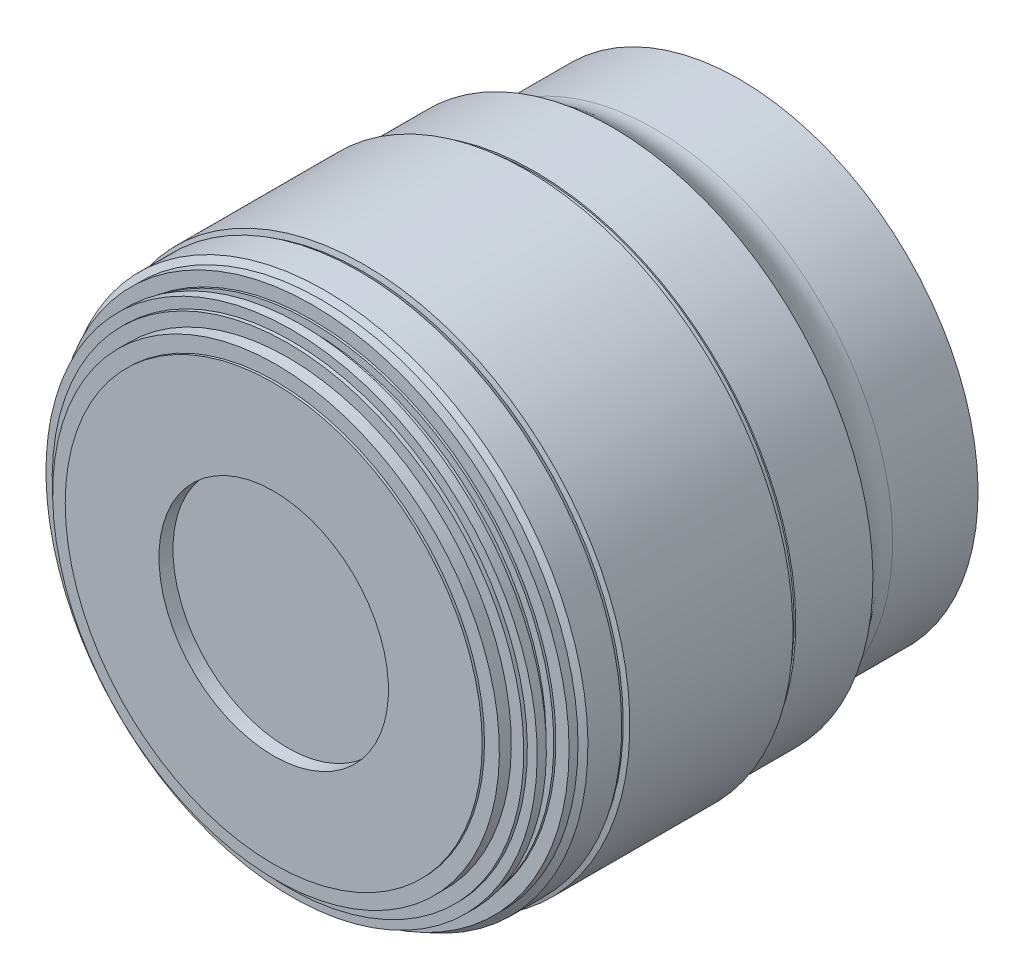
SolidWorks part; units mm, degrees
other "updated"
other "too small"
ref_plane "Front Plane" through (0, 0, 0) normal (0, 0, 1) x (1, 0, 0)
ref_plane "Top Plane" through (0, 0, 0) normal (0, 1, 0) x (1, 0, 0)
ref_plane "Right Plane" through (0, 0, 0) normal (1, 0, 0) x (0, 0, -1)
sketch "Sketch1" plane through (0, 0, 0) normal (1, 0, 0) x (0, 0, -1)
  line L0 (-736.0649, 115.0747) -> (23.9351, 115.0747) construction
sketch "Sketch2" plane through (0, 0, 0) normal (1, 0, 0) x (0, 0, -1)
  line B0 (0, 0) -> (-471.9893, 0)
  line B1 (0, 0) -> (0, 155.4973)
  line B2 (0, 155.4973) -> (-12.7948, 155.4973)
  line B3 (-12.7948, 155.4973) -> (-12.7948, 154.2945)
  line B4 (-12.7948, 154.2945) -> (-28.6883, 154.2945)
  line B5 (-28.6883, 154.2945) -> (-28.6883, 166.408)
  line B6 (-28.6883, 166.408) -> (-37.3653, 166.408)
  line B7 (-37.3653, 166.408) -> (-37.3653, 207.1469)
  line B8 (-37.3653, 207.1469) -> (-39.4783, 207.1469)
  line B9 (-39.4783, 207.1469) -> (-39.4783, 218.1634)
  line B10 (-39.4783, 218.1634) -> (-108.3379, 218.1634)
  line B11 (-149.8432, 238.8143) -> (-230.492, 238.8143)
  line B12 (-230.492, 238.8143) -> (-230.492, 235.6571)
  line B13 (-230.492, 235.6571) -> (-234.1288, 235.6571)
  line B14 (-234.1288, 235.6571) -> (-238.6808, 242.6516)
  line B15 (-238.6808, 242.6516) -> (-376.9383, 242.6516)
  line B16 (-376.9383, 242.6516) -> (-382.2862, 238.1946)
  line B17 (-382.2862, 238.1946) -> (-386.0216, 240.4231)
  line B18 (-386.0216, 240.4231) -> (-419.6297, 240.4231)
  line B19 (-419.6297, 240.4231) -> (-423.3041, 234.2639)
  line B20 (-423.3041, 234.2639) -> (-433.5787, 234.2639)
  line B21 (-433.5787, 234.2639) -> (-433.5787, 221.5093)
  line B22 (-433.5787, 221.5093) -> (-435.7, 221.5093)
  line B23 (-435.7, 221.5093) -> (-435.7, 213.879)
  line B24 (-435.7, 213.879) -> (-445.132, 213.879)
  line B25 (-445.132, 213.879) -> (-445.132, 223.6253)
  line B26 (-445.132, 223.6253) -> (-454.2554, 223.6253)
  line B27 (-454.2554, 223.6253) -> (-454.2554, 213.879)
  line B28 (-454.2554, 213.879) -> (-457.8412, 213.879)
  line B29 (-457.8412, 213.879) -> (-457.8412, 201.5319)
  line B30 (-457.8412, 201.5319) -> (-469.7007, 201.5319)
  line B31 (-469.7007, 201.5319) -> (-469.7007, 186.7774)
  line B32 (-469.7007, 186.7774) -> (-471.9893, 186.7774)
  line B33 (-471.9893, 186.7774) -> (-471.9893, 0)
  line B34 (-104.0623, 218.1634) -> (-112.6134, 218.1634) construction
  spline B35 degree 3 poles (-149.8432, 238.8143) (-137.6539, 228.0487) (-127.1212, 218.1634) (-108.3379, 218.1634) knots 0 0 0 0 1 1 1 1
sketch_block_instance "Block1-1"
sketch_block "Block1"
sketch "Sketch3" plane through (0, 0, 0) normal (1, 0, 0) x (0, 0, -1)
  line L36 (-19.4478, 30.9952) -> (-19.4478, 0) construction
  dimension "D1" = 30.9952
sketch_block_instance "Block2-1"
sketch_block "Block2"
revolve "Revolve2" add sketch "Sketch3" angle 360 about L0
sketch "Sketch4" plane through (0, 0, 0) normal (1, 0, 0) x (0, 0, -1)
  line L36 (-19.4478, 33.55) -> (-19.4478, 0) construction
  line L37 (0, 0) -> (-63.061, 0)
  line L39 (0, 22.5667) -> (-0.3172, 22.5667)
  line L40 (-0.3172, 22.5667) -> (-0.3172, 22.3985)
  line L41 (-0.3172, 22.3985) -> (-1.6606, 22.3985)
  line L42 (-1.6606, 22.3985) -> (-1.6606, 23.9828)
  line L43 (-1.6606, 23.9828) -> (-2.7867, 23.9828)
  line L44 (-2.7867, 23.9828) -> (-2.7867, 29.2702)
  line L45 (-2.7867, 29.2702) -> (-3.061, 29.2702)
  line L46 (-3.061, 29.2702) -> (-3.061, 30.7)
  line L47 (-3.061, 30.7) -> (-14.061, 30.7)
  line L48 (-19.4478, 33.55) -> (-29.385, 33.55)
  line L49 (-29.385, 33.55) -> (-29.385, 33.3422)
  line L50 (-29.385, 33.3422) -> (-29.8571, 33.3422)
  line L51 (-29.8571, 33.3422) -> (-30.4478, 34.25)
  line L52 (-30.4478, 34.25) -> (-51.4478, 34.25)
  line L53 (-51.4478, 34.25) -> (-51.5992, 33.55)
  line L54 (-51.5992, 33.55) -> (-52.1021, 33.85)
  line L55 (-52.1021, 33.85) -> (-56.4478, 33.85)
  line L56 (-56.4478, 33.85) -> (-56.9247, 33.0506)
  line L57 (-56.9247, 33.0506) -> (-58.0757, 33.0506)
  line L58 (-58.0757, 33.0506) -> (-58.0757, 31.354)
  line L59 (-58.0757, 31.354) -> (-58.351, 31.354)
  line L60 (-58.351, 31.354) -> (-58.351, 30.3637)
  line L61 (-58.351, 30.3637) -> (-59.5752, 30.3637)
  line L62 (-59.5752, 30.3637) -> (-59.5752, 31.6287)
  line L63 (-59.5752, 31.6287) -> (-60.7593, 31.6287)
  line L64 (-60.7593, 31.6287) -> (-60.7593, 30.3637)
  line L65 (-60.7593, 30.3637) -> (-61.2247, 30.3637)
  line L66 (-61.2247, 30.3637) -> (-61.2247, 28.7612)
  line L67 (-61.2247, 28.7612) -> (-62.7639, 28.7612)
  line L68 (-62.7639, 28.7612) -> (-62.7639, 26.8462)
  line L69 (-62.7639, 26.8462) -> (-63.061, 26.8462)
  line L71 (-13.506, 30.7) -> (-14.6159, 30.7) construction
  line L72 (-63.061, 26.8462) -> (-63.061, 0)
  line L73 (0, 22.5667) -> (0, 0)
  spline S0 degree 3 poles (-19.4478, 33.55) (-17.7825, 32.3073) (-16.4988, 30.7) (-14.061, 30.7) knots 0 0 0 0 1 1 1 1
  point P40 (-51.5992, 33.55)
  point P43 (-0.3172, 22.3985)
  dimension "D1" = 33.55
  dimension "D2" = 33.85
  dimension "D3" = 34.25
  dimension "D4" = 30.7
  dimension "D5" = 60
  dimension "D6" = 21
  dimension "D7" = 11
  dimension "D8" = 5
  dimension "D9" = 11
revolve "Revolve3" add sketch "Sketch4" angle 360 about L37
sketch "Sketch5" plane through (0, 0, 0) normal (1, 0, 0) x (0, 0, -1)
  line L0 (-736.0649, 115.0747) -> (23.9351, 115.0747) construction
  line L1 (-54.0545, 0) -> (-48.7996, 0) construction
  line L2 (-50.1885, 14.7733) -> (-48.7996, 14.7733) construction
  line L3 (-48.7996, 14.7733) -> (-48.7996, 0) construction
  line L4 (-54.0545, 0) -> (-71.879, 0)
  line L5 (-71.879, 0) -> (-71.879, 14.7733)
  line L6 (-71.879, 14.7733) -> (-50.1885, 14.7733)
  spline S0 degree 2 poles (-54.0545, 0) (-53.9832, 7.818) (-50.1885, 14.7733) knots 0 0 0 1 1 1
revolve "Cut-Revolve1" cut sketch "Sketch5" angle 360 about L4
